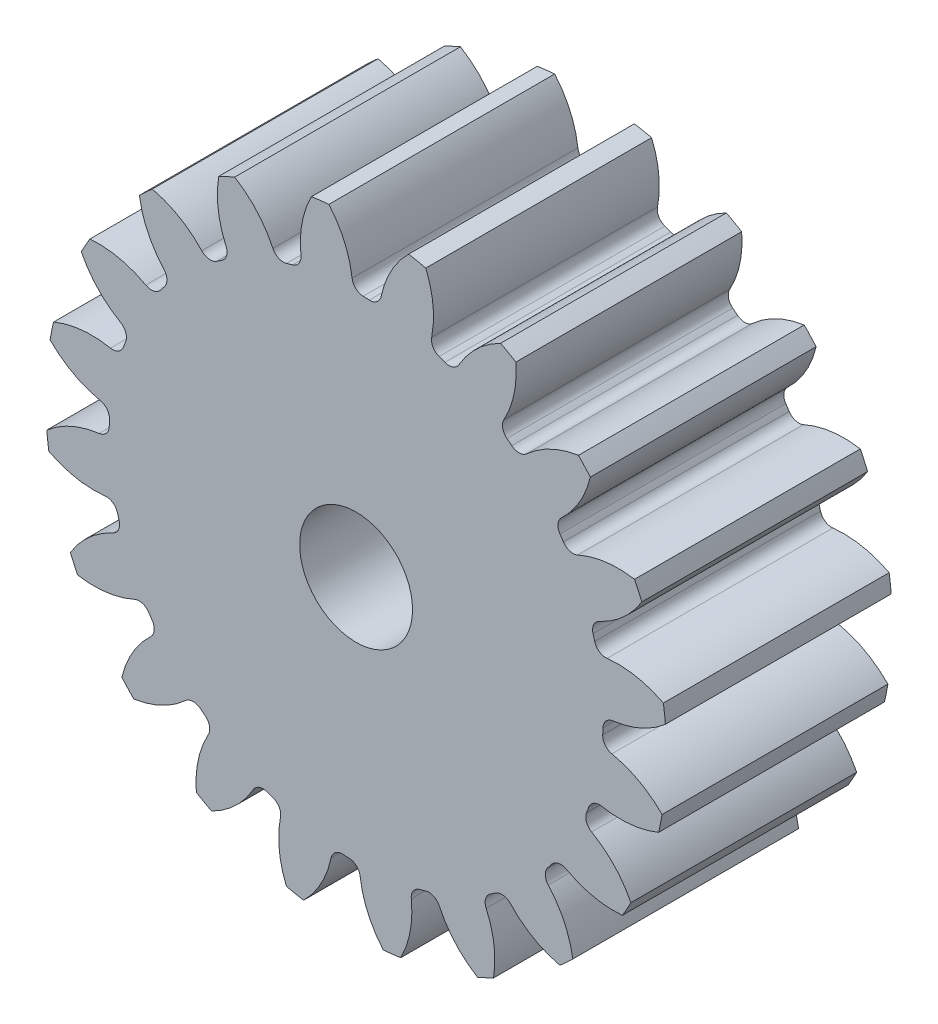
SolidWorks part; units mm, degrees
ref_plane "Front" through (0, 0, 0) normal (0, 0, 1) x (1, 0, 0)
ref_plane "Top" through (0, 0, 0) normal (0, 1, 0) x (1, 0, 0)
ref_plane "Right" through (0, 0, 0) normal (1, 0, 0) x (0, 0, -1)
sketch "Sketch3" plane through (0, 0, 0) normal (0, 0, 1) x (1, 0, 0)
  circle A0 centre (0, 0) radius 139.7
  dimension "od" = 279.4
extrude "gearBody" add sketch "Sketch3" along normal blind 101.6
sketch "Sketch2" plane through (0, 0, 0) normal (0, 0, 1) x (1, 0, 0)
  line L0 (0, 0) -> (110.2567, 45.6698) construction
  line L1 (138.1858, -24.133) -> (0, 0) construction
  line L2 (0, 0) -> (36.3143, 0) construction
  line L3 (126.9117, 4.7347) -> (126.0952, -15.1325) construction
  line L5 (126.5035, -5.1989) -> (0, 0) construction
  line L7 (0, 0) -> (119.341, 0) construction
  arc A0 (119.3165, 2.4148) -> (118.716, -12.1972) centre (0, 0) ccw construction
  arc A1 (139.1627, 12.2406) -> (137.689, -23.6183) centre (0, 0) ccw construction
  arc A2 (126.9117, 4.7347) -> (126.0952, -15.1325) centre (0, 0) ccw construction
  arc A3 (110.9658, -5.9453) -> (111.0795, -3.18) centre (0, 0) ccw
  arc A4 (138.1858, -24.133) -> (115.0813, -11.2838) centre (106.1374, -54.5629) ccw
  arc A5 (138.1858, -24.133) -> (139.7, 12.7128) centre (0, 0) ccw
  arc A6 (139.7, 12.7128) -> (115.6191, 1.8028) centre (110.2567, 45.6698) cw
  arc A7 (111.0795, -3.18) -> (115.6191, 1.8028) centre (116.2463, -3.328) cw
  arc A8 (115.0813, -11.2838) -> (110.9658, -5.9453) centre (116.1273, -6.2219) cw
  point P6 (139.7, 12.7128)
  point P22 (138.1858, -24.133)
  dimension "baseDia" = 238.6819
  dimension "od" = 279.4
  dimension "pd" = 254
  dimension "rd" = 222.25
  dimension "rFillet" = 5.1689
  dimension "pointX" = 139.7
  dimension "pointY" = 12.7128
  dimension "CTT" = 19.8672
  dimension "flankCenterAngle" = 22.5
extrude "toothCut" cut sketch "Sketch2" along normal through all
pattern_circular "CirPattern1" count 20 over 360 about axis through (0, 0, 0) along (0, 0, 1) of "toothCut"
sketch "hub1Dia" plane through (0, 0, 0) normal (0, 0, -1) x (-1, 0, 0)
  circle A0 centre (0, 0) radius 12.7
  dimension "hub1Dia" = 25.4
sketch "hub2Dia" plane through (0, 0, 101.6) normal (0, 0, 1) x (1, 0, 0)
  circle A0 centre (0, 0) radius 12.7
  dimension "hub2dia" = 25.4
sketch "boreDia" plane through (0, 0, 0) normal (0, 0, 1) x (1, 0, 0)
  circle A0 centre (0, 0) radius 25.4
  dimension "boreDia" = 50.8
extrude "bore" cut sketch "boreDia" against normal mid plane 25400
